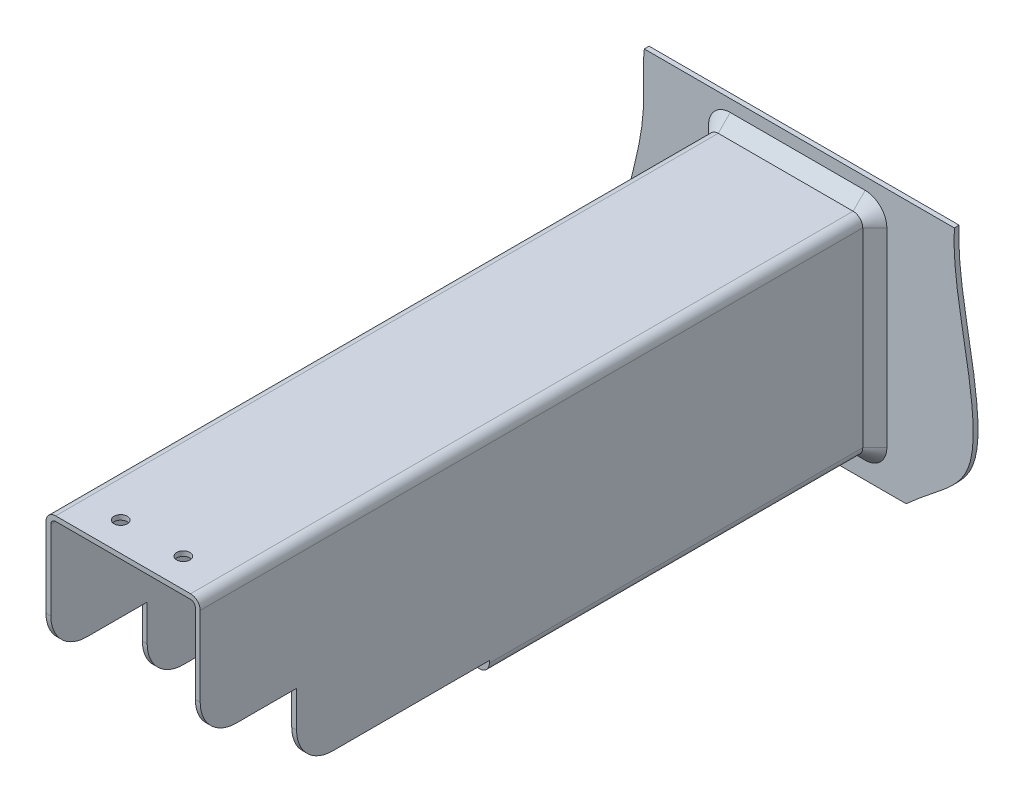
SolidWorks part; units mm, degrees
ref_plane "Plan de face" through (0, 0, 0) normal (0, 0, 1) x (1, 0, 0)
ref_plane "Plan de dessus" through (0, 0, 0) normal (0, 1, 0) x (1, 0, 0)
ref_plane "Plan de droite" through (0, 0, 0) normal (1, 0, 0) x (0, 0, -1)
sketch "Esquisse1" plane through (0, 0, 0) normal (0, 0, 1) x (1, 0, 0)
  line L1 (-30, 0) -> (30, 0)
  line L2 (-30, 0) -> (-30, 2)
  line L3 (-30, 2) -> (30, 2)
  line L4 (30, 0) -> (30, 2)
  dimension "D1" = 2
  dimension "D2" = 60
extrude "Extrusion1" add sketch "Esquisse1" against normal blind 280
sketch "Esquisse2" plane through (0, 2, 0) normal (0, 1, 0) x (-1, 0, 0)
  line L0 (-30, 0) -> (30, 0) construction
  line L1 (-30, 0) -> (-32, 0)
  line L2 (-30, 0) -> (-30, -280)
  line L3 (-30, -280) -> (-32, -280)
  line L4 (-32, 0) -> (-32, -280)
  line L5 (30, -280) -> (32, -280)
  line L6 (30, -280) -> (30, 0)
  line L7 (30, 0) -> (32, 0)
  line L8 (32, -280) -> (32, 0)
  line L11 (-30, -280) -> (30, -280) construction
  dimension "D1" = 2
  dimension "D2" = 2
extrude "Extrusion2" add sketch "Esquisse2" against normal blind 52
fillet "Congé1" radius 2 2 edges
fillet "Congé2" radius 4 2 edges at (32, 2, -140) (-32, 2, -140)
fillet "Congé3" radius 15 2 edges at (31, -50, 0) (-31, -50, 0)
sketch "Esquisse3" plane through (0, 2, 0) normal (0, 1, 0) x (-1, 0, 0)
  line L0 (-28, 0) -> (28, 0) construction
  circle A0 centre (-13, -12) radius 2.75
  circle A2 centre (13, -12) radius 2.75
  dimension "D1" = 5.5
  dimension "D2" = 5.5
  dimension "D5" = 12
  dimension "D3" = 26
  dimension "D4" = 13
  dimension "D6" = 12
extrude "Enlèv. mat.-Extru.1" cut sketch "Esquisse3" against normal blind 52
sketch "Esquisse4" plane through (32, 0, 0) normal (1, 0, 0) x (0, 0, -1)
  line L1 (280, -50) -> (40, -50)
  line L2 (280, -50) -> (280, -85)
  line L3 (280, -85) -> (40, -85)
  line L4 (40, -50) -> (40, -85)
  dimension "D1" = 35
  dimension "D2" = 240
extrude "Extrusion3" add sketch "Esquisse4" against normal blind 2
mirror "Symétrie1" about plane through (0, 0, 0) normal (1, 0, 0) of "Extrusion3"
sketch "Esquisse5" plane through (0, 0, -280) normal (0, 0, -1) x (-1, 0, 0)
  line L0 (-45.0158, -97.1519) -> (57.1345, -97.1519)
  line L1 (-65.0028, 12) -> (63.6643, 12)
  line L2 (-28, 2) -> (28, 2) construction
  circle A0 centre (0, -45) radius 27.5
  point P11 (-72.2933, -47.8913)
  point P13 (-69.4401, -74.2046)
  point P15 (-52.016, -91.1098)
  point P22 (64.8803, -91.585)
  point P24 (71.0029, -82.4473)
  point P26 (68.4667, -34.5762)
  point P28 (63.9299, -6.5263)
  dimension "D1" = 55
  dimension "D2" = 45
  dimension "D3" = 10
extrude "Extrusion4" add sketch "Esquisse5" along normal blind 2
sketch "Esquisse6" plane through (0, 0, -280) normal (0, 0, 1) x (1, 0, 0)
  line L0 (-30, -85) -> (-30, -2) construction
  line L1 (30, -85) -> (-30, -85)
  line L2 (30, -85) -> (30, -83)
  line L3 (30, -83) -> (-30, -83)
  line L4 (-30, -85) -> (-30, -83)
  dimension "D1" = 2
extrude "Extrusion5" add sketch "Esquisse6" along normal blind 160
sketch "Esquisse7" plane through (32, 0, 0) normal (1, 0, 0) x (0, 0, -1)
  line L1 (120, -85) -> (32.0811, -85)
  line L2 (120, -85) -> (120, -80)
  line L3 (120, -80) -> (32.0811, -80)
  line L4 (32.0811, -85) -> (32.0811, -80)
  dimension "D2" = 5
extrude "Enlèv. mat.-Extru.2" cut sketch "Esquisse7" against normal through all
fillet "Congé6" radius 4 2 edges at (-32, -85, -200) (32, -85, -200)
fillet "Congé7" radius 2 1 edges at (-30, -83, -200)
fillet "Congé8" radius 15 2 edges at (31, -80, -40) (-31, -80, -40)
fillet "Congé9" radius 2 1 edges at (30, -83, -200)
chamfer "Chanfrein1" distance 5 angle 45 8 edges at (-30.8284, 0.8284, -280) (0, 2, -280) (30.8284, 0.8284, -280) (32, -41.5, -280) (30.8284, -83.8284, -280) (-32, -41.5, -280) (-30.8284, -83.8284, -280) (0, -85, -280)
